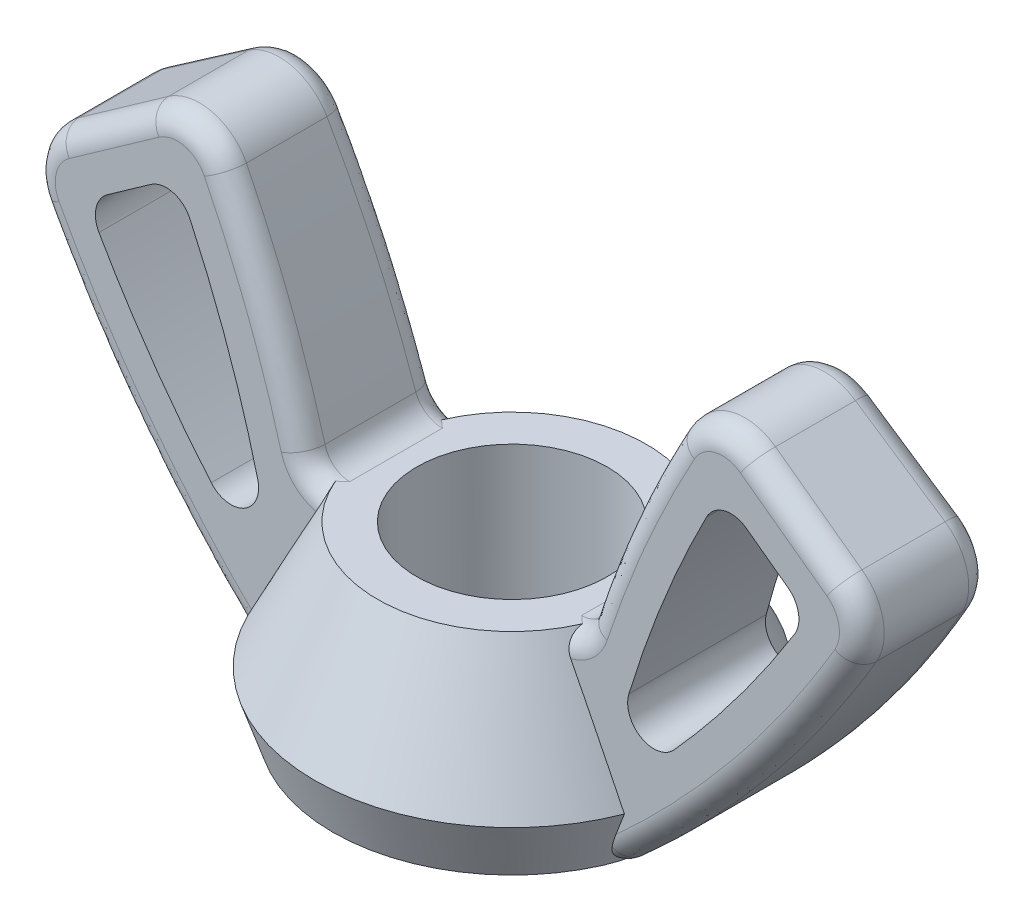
SolidWorks part; units mm, degrees
ref_plane "Front Plane" through (0, 0, 0) normal (0, 0, 1) x (1, 0, 0)
ref_plane "Top Plane" through (0, 0, 0) normal (0, 1, 0) x (1, 0, 0)
ref_plane "Right Plane" through (0, 0, 0) normal (1, 0, 0) x (0, 0, -1)
sketch "BaseNutSke" plane through (0, 0, 0) normal (0, 0, 1) x (1, 0, 0)
  line L0 (0, 0) -> (-8, 0)
  line L2 (-6, 8) -> (0, 8)
  line L3 (0, 8) -> (0, 0)
  line L4 (0, -38.5148) -> (0, 38.5148) construction
  line L5 (-6, 8) -> (-8.8, 2.4)
  line L6 (-8.8, 2.4) -> (-8, 0)
revolve "BaseNut" add sketch "BaseNutSke" angle 360 about L4
sketch "BaseWingSke" plane through (0, 0, 0) normal (1, 0, 0) x (0, 0, -1)
  line L0 (0, 0) -> (0, 62.8635) construction
  line L1 (-2.75, 19) -> (-3.25, 0)
  line L2 (-2.75, 19) -> (2.75, 19)
  line L3 (2.75, 19) -> (3.25, 0)
  line L4 (3.25, 0) -> (-3.25, 0)
  point P8 (0, 19)
  dimension "TopWing_Width" = 5.5
  dimension "BottomWing_Width" = 6.5
  dimension "Height" = 19
extrude "BaseWing" add sketch "BaseWingSke" along normal mid plane 37
sketch "CutWingSke" plane through (0, 0, 0) normal (0, 0, 1) x (1, 0, 0)
  line L0 (0, 0) -> (0, 84.5075) construction
  line L3 (18.5, 19) -> (-18.5, 19) construction
  line L4 (-18.5, 19) -> (-18.5, 0) construction
  line L5 (-7.3101, 0) -> (7.3101, 0) construction
  line L6 (5.1732, 8) -> (-5.1732, 8) construction
  line L7 (13.5447, 18.566) -> (17.4766, 15.8128)
  line L8 (-13.5447, 18.566) -> (-17.4766, 15.8128)
  line L9 (-7.3101, 0) -> (-18.5, 0) construction
  line L10 (-28.5, 29) -> (28.5, 29)
  line L11 (-28.5, 29) -> (-28.5, -10)
  line L12 (-28.5, -10) -> (28.5, -10)
  line L13 (28.5, 29) -> (28.5, -10)
  line L14 (18.5, 19) -> (18.5, 0) construction
  line L16 (-7.3101, 0) -> (7.3101, 0)
  line L17 (5.1732, 8) -> (-5.1732, 8)
  arc A0 (-5.1732, 8) -> (-6.3192, 8.8442) centre (-5.1732, 9.2) cw
  arc A1 (-7.3101, 0) -> (-8.1072, 0.303) centre (-7.3101, 1.2) cw
  arc A2 (-17.4766, 15.8128) -> (-18.1775, 12.6452) centre (-16.1, 13.8468) ccw
  arc A3 (-10.0553, 17.7386) -> (-13.5447, 18.566) centre (-12.1681, 16.6) ccw
  arc A4 (-10.0553, 17.7386) -> (-6.3192, 8.8442) centre (-54.0704, -5.9821) cw
  arc A5 (-18.1775, 12.6452) -> (-8.1072, 0.303) centre (25.1037, 37.68) ccw
  arc A6 (7.3101, 0) -> (8.1072, 0.303) centre (7.3101, 1.2) ccw
  arc A7 (18.1775, 12.6452) -> (8.1072, 0.303) centre (-25.1037, 37.68) cw
  arc A8 (17.4766, 15.8128) -> (18.1775, 12.6452) centre (16.1, 13.8468) cw
  arc A9 (10.0553, 17.7386) -> (13.5447, 18.566) centre (12.1681, 16.6) cw
  arc A10 (10.0553, 17.7386) -> (6.3192, 8.8442) centre (54.0704, -5.9821) ccw
  arc A11 (5.1732, 8) -> (6.3192, 8.8442) centre (5.1732, 9.2) ccw
extrude "CutWing" cut sketch "CutWingSke" against normal mid plane 37
sketch "HoleSke" plane through (0, 0, 0) normal (0, 1, 0) x (1, 0, 0)
  circle A0 centre (0, 0) radius 4.25
extrude "TappedHole" cut sketch "HoleSke" along normal through all
chamfer "Chamfer1" distance 0.5667 angle 60 1 edges at (0, 0, 4.25)
sketch "HollowSke" plane through (0, 0, 0) normal (0, 0, 1) x (1, 0, 0)
  line L0 (-13.2891, 15.815) -> (-15.1878, 14.4855)
  line L1 (13.2891, 15.815) -> (15.1878, 14.4855)
  line L2 (-13.5447, 18.566) -> (-17.4766, 15.8128) construction
  line L3 (0, 0) -> (0, 22.0794) construction
  arc A0 (-11.5283, 15.3704) -> (-8.282, 7.0249) centre (-54.0704, -5.9821) cw
  arc A1 (-15.5238, 12.8773) -> (-10.3296, 5.8957) centre (25.1037, 37.68) ccw
  arc A4 (-6.3192, 8.8442) -> (-10.0553, 17.7386) centre (-54.0704, -5.9821) ccw construction
  arc A5 (-18.1775, 12.6452) -> (-8.1072, 0.303) centre (25.1037, 37.68) ccw construction
  arc A6 (-13.2891, 15.815) -> (-11.5283, 15.3704) centre (-12.6008, 14.8321) cw
  arc A7 (-15.1878, 14.4855) -> (-15.5238, 12.8773) centre (-14.4995, 13.5026) ccw
  arc A8 (-8.282, 7.0249) -> (-10.3296, 5.8957) centre (-9.4364, 6.697) cw
  arc A9 (8.282, 7.0249) -> (10.3296, 5.8957) centre (9.4364, 6.697) ccw
  arc A10 (15.5238, 12.8773) -> (10.3296, 5.8957) centre (-25.1037, 37.68) cw
  arc A11 (15.1878, 14.4855) -> (15.5238, 12.8773) centre (14.4995, 13.5026) cw
  arc A12 (13.2891, 15.815) -> (11.5283, 15.3704) centre (12.6008, 14.8321) ccw
  arc A13 (11.5283, 15.3704) -> (8.282, 7.0249) centre (54.0704, -5.9821) ccw
extrude "HollowWing" cut sketch "HollowSke" against normal mid plane 10
fillet "Fillet1" radius 1 28 edges at (7.7364, 0.0783, -3.2479) (13.637, 6.0704, -3.0903) (18.4433, 14.3653, -2.872) (15.5106, 17.1894, -2.7976) (11.6143, 18.9352, -2.7517) (5.8849, 8.2338, -3.0333) (5.8849, 8.2338, 3.0333) (7.7364, 0.0783, 3.2479) (13.637, 6.0704, 3.0903) (18.4433, 14.3653, 2.872) (15.5106, 17.1894, 2.7976) (11.6143, 18.9352, 2.7517) (-5.8849, 8.2338, -3.0333) (-7.7364, 0.0783, -3.2479) (-13.637, 6.0704, -3.0903) (-18.4433, 14.3653, -2.872) (-15.5106, 17.1894, -2.7976) (-11.6143, 18.9352, -2.7517) (-7.7364, 0.0783, 3.2479) (-13.637, 6.0704, 3.0903) (-18.4433, 14.3653, 2.872) (-15.5106, 17.1894, 2.7976) (-11.6143, 18.9352, 2.7517) (-5.8849, 8.2338, 3.0333) (7.9723, 13.3817, -2.8978) (7.9723, 13.3817, 2.8978) (-7.9723, 13.3817, -2.8978) (-7.9723, 13.3817, 2.8978)
sketch "ThdSchSke" plane through (0, 0, 0) normal (0, 0, 1) x (1, 0, 0)
  line L0 (4.25, 0.5667) -> (3.384, 0.5667)
  line L1 (3.384, 0.5667) -> (3.384, 1.4327)
  line L2 (3.384, 1.4327) -> (4.25, 1.4327)
  line L3 (4.25, 1.4327) -> (5, 0.9997)
  line L4 (5, 0.9997) -> (4.25, 0.5667)
  line L5 (0, -3.4614) -> (0, 8.4929) construction
  line L6 (-4.25, 0.5667) -> (4.25, 0.5667) construction
revolve "ThreadSchematic" [suppressed] cut sketch "ThdSchSke" angle 360 about L5
pattern_linear "ThdSchPat" [suppressed]
equation "\"D1@BaseNutSke\" = \"Nut_Height@BaseNutSke\"*0.7"
equation "\"D2@BaseNutSke\" = \"Bottom_Width@BaseNutSke\"*1.1"
equation "\"D5@CutWingSke\" = \"Top_Width@BaseNutSke\"/10"
equation "\"D7@CutWingSke\" = \"Top_Width@BaseNutSke\"*0.2"
equation "\"D9@CutWingSke\" = \"Top_Width@BaseNutSke\"*0.4"
equation "\"D1@CutWing\" = \"Width@BaseWing\""
equation "\"D1@Chamfer1\" = \"Tap_drill@HoleSke\"/15"
equation "\"D1@HollowSke\" = \"Top_Width@BaseNutSke\"/5"
equation "\"D2@HollowSke\" = \"Top_Width@BaseNutSke\"/5"
equation "\"D3@HollowSke\" = \"Top_Width@BaseNutSke\"/5"
equation "\"D4@HollowSke\" = \"Top_Width@BaseNutSke\"/10"
equation "\"D1@Fillet1\" = \"Top_Width@BaseNutSke\"/12"
equation "\"D1@ThdSchSke\" = \"Tap_drill@HoleSke\""
equation "\"ThreadN@ThdSchSke\"=\"Thread_major@ThreadCosmetic\""
equation "\"Num_threads@ThdSchPat\" = int( \"Nut_Height@BaseNutSke\"/\"Advance@ThdSchPat\" ) +1"
